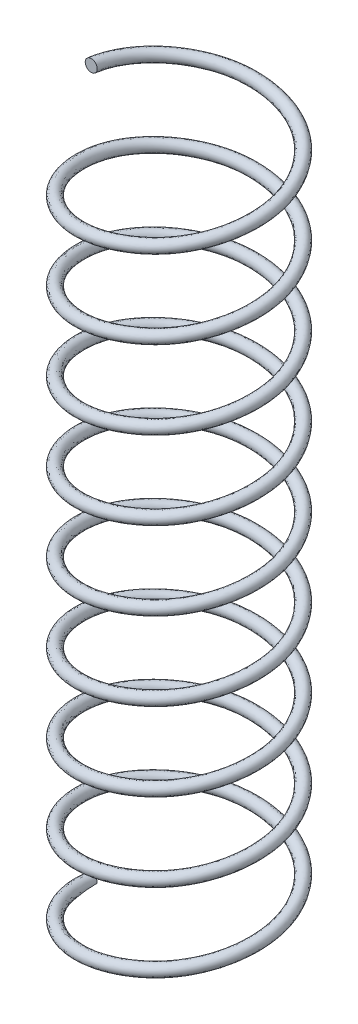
SolidWorks part; units mm, degrees
ref_plane "Front Plane" through (0, 0, 0) normal (0, 0, 1) x (1, 0, 0)
ref_plane "Top Plane" through (0, 0, 0) normal (0, 1, 0) x (1, 0, 0)
ref_plane "Right Plane" through (0, 0, 0) normal (1, 0, 0) x (0, 0, -1)
sketch "Sketch1" plane through (0, 0, 0) normal (0, 0, 1) x (1, 0, 0)
  line L0 (0, 0) -> (0, 28.2614)
  line L2 (-3.0101, 28.2614) -> (3.0099, 28.2614) construction
sketch "Sketch2" plane through (0, 0, 0) normal (0, 0, 1) x (1, 0, 0)
  circle A0 centre (-3.5179, 0) radius 0.2413
  dimension "D1" = 0.4826
  dimension "D2" = 3.5179
sweep "Sweep2" add profiles "Sketch2" path "Sketch1" parameters "D1"=3240
other "SurfaceCut1"
